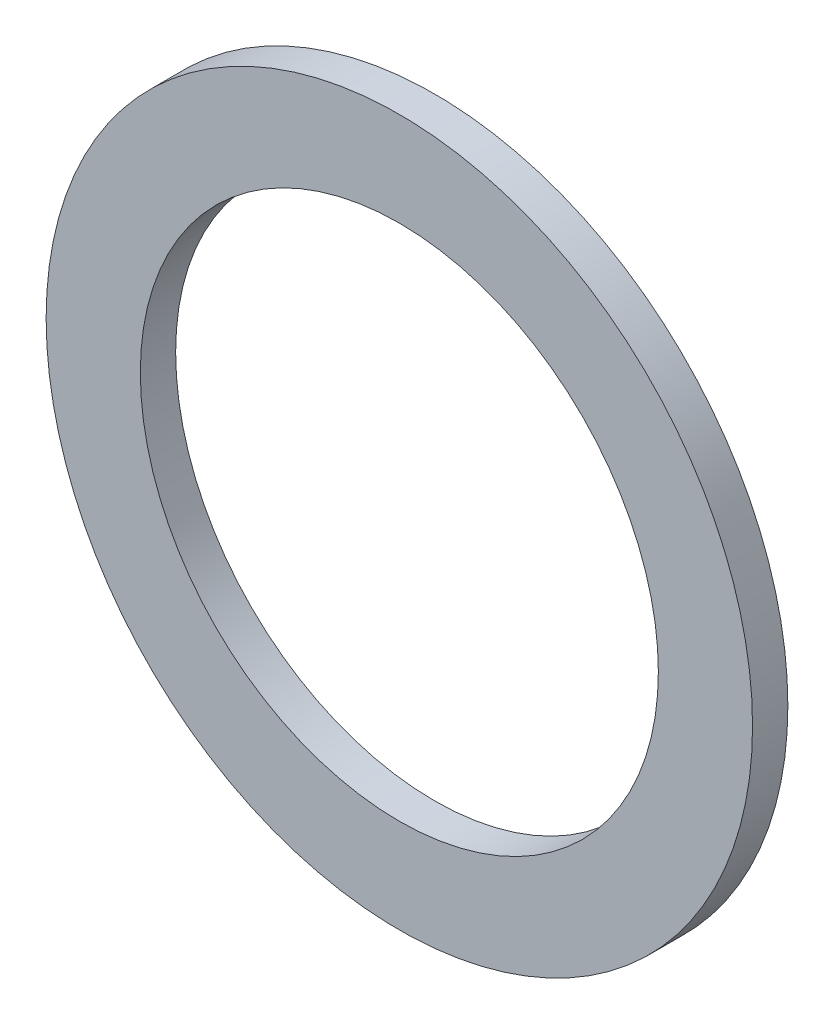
SolidWorks part; units mm, degrees
ref_plane "Plan1" through (0, 0, 0) normal (0, 0, 1) x (1, 0, 0)
ref_plane "Plan2" through (0, 0, 0) normal (0, 1, 0) x (1, 0, 0)
ref_plane "Plan3" through (0, 0, 0) normal (1, 0, 0) x (0, 0, -1)
sketch "Esquisse1" plane through (0, 0, 0) normal (0, 0, 1) x (1, 0, 0)
  circle A0 centre (0, 0) radius 30
  circle A1 centre (0, 0) radius 22
  dimension "D1" = 60
  dimension "D2" = 44
extrude "Base-Extrusion" add sketch "Esquisse1" along normal blind 3
